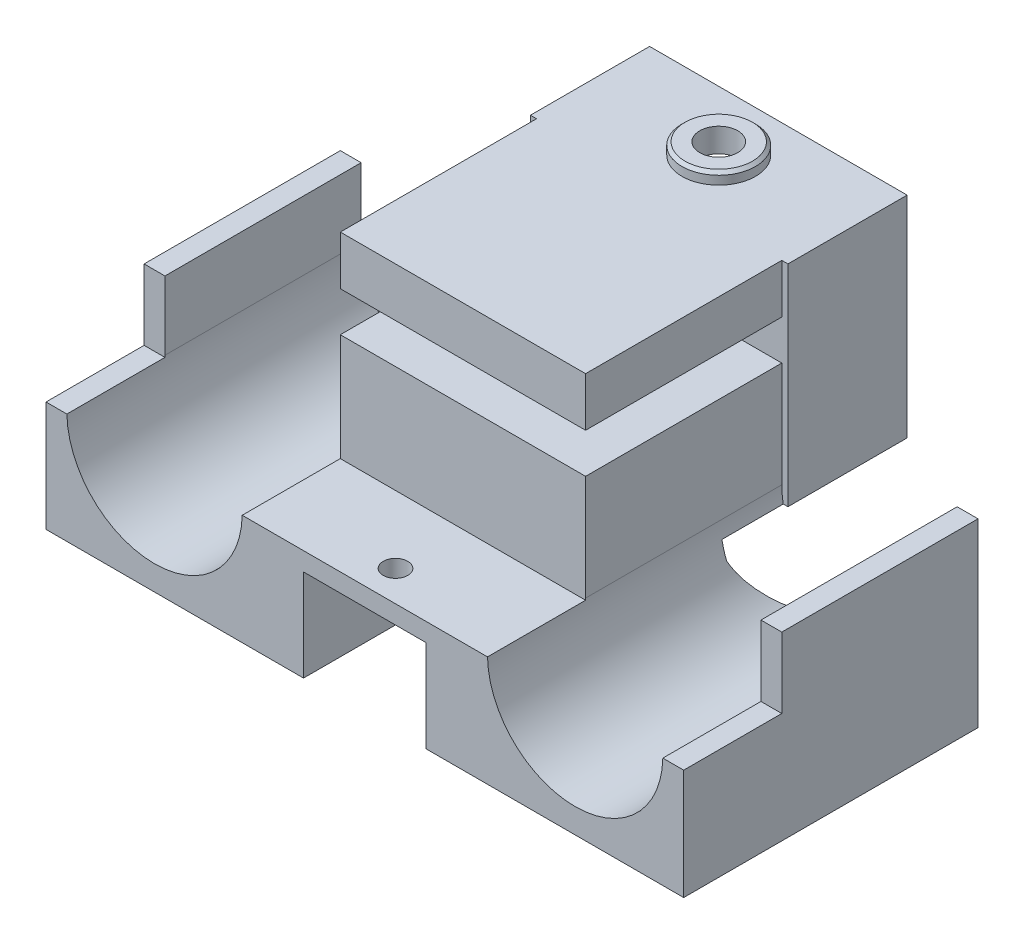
SolidWorks part; units mm, degrees
ref_plane "Front Plane" through (0, 0, 0) normal (0, 0, 1) x (1, 0, 0)
ref_plane "Top Plane" through (0, 0, 0) normal (0, 1, 0) x (1, 0, 0)
ref_plane "Right Plane" through (0, 0, 0) normal (1, 0, 0) x (0, 0, -1)
sketch "Sketch1" plane through (0, 0, 0) normal (0, 1, 0) x (1, 0, 0)
  line L1 (-10.5, -4.86) -> (10.5, -4.86)
  line L2 (-10.5, -4.86) -> (-10.5, 4.86)
  line L3 (-10.5, 4.86) -> (10.5, 4.86)
  line L4 (10.5, -4.86) -> (10.5, 4.86)
  line L5 (-10.5, -4.86) -> (10.5, 4.86) construction
  line L6 (-10.5, 4.86) -> (10.5, -4.86) construction
  point P0 (0, 0)
  dimension "D1" = 9.72
  dimension "D2" = 21
extrude "Boss-Extrude1" add sketch "Sketch1" along normal mid plane 17.15 contours L2 L3 L4 L1
sketch "Sketch2" plane through (0, 8.575, 0) normal (0, 1, 0) x (1, 0, 0)
  circle A0 centre (0, 0) radius 3
  circle A1 centre (0, 0) radius 1.55
  dimension "D1" = 6
  dimension "D2" = 3.1
extrude "Boss-Extrude2" add sketch "Sketch2" along normal blind 0.95 contours A0 | A1
chamfer "Chamfer1" distance 0.25 angle 45 1 edges at (0, 9.525, 3)
sketch "Sketch4" plane through (0, 8.575, 0) normal (0, 1, 0) x (1, 0, 0)
  circle A0 centre (0, 0) radius 1.55 construction
  circle A1 centre (0, 0) radius 1.55
extrude "Cut-Extrude2" cut sketch "Sketch4" against normal through all
mirror "Mirror1" about plane through (0, 0, 0) normal (0, 1, 0) of "Boss-Extrude2", "Chamfer1"
sketch "Sketch3" plane through (0, 0, -4.86) normal (0, 0, -1) x (-1, 0, 0)
  line L0 (10.5, 8.575) -> (-10.5, 8.575) construction
  line L1 (8.5, -6.825) -> (-8.5, -6.825)
  line L2 (8.5, -6.825) -> (8.5, 6.825)
  line L3 (8.5, 6.825) -> (-8.5, 6.825)
  line L4 (-8.5, -6.825) -> (-8.5, 6.825)
  line L5 (8.5, -6.825) -> (-8.5, 6.825) construction
  line L6 (8.5, 6.825) -> (-8.5, -6.825) construction
  line L7 (-10.5, 8.575) -> (-10.5, -8.575) construction
  point P0 (0, 0)
  dimension "D1" = 1.75
  dimension "D2" = 2
extrude "Cut-Extrude1" cut sketch "Sketch3" against normal blind 8.72 contours L4 L3 L2 L1
sketch "Sketch6" plane through (0, 6.825, 0) normal (0, -1, 0) x (1, 0, 0)
  circle A0 centre (0, 0) radius 3
  dimension "D1" = 6
extrude "Cut-Extrude3" cut sketch "Sketch6" against normal blind 0.75
mirror "Mirror2" about plane through (0, 0, 0) normal (0, 1, 0) of "Cut-Extrude3"
sketch "Sketch7" plane through (0, 0, 4.86) normal (0, 0, 1) x (1, 0, 0)
  line L1 (-10.5, 4.575) -> (10.5, 4.575)
  line L2 (-10.5, 4.575) -> (-10.5, 1.325)
  line L3 (-10.5, 1.325) -> (10.5, 1.325)
  line L4 (-10.5, -8.575) -> (10.5, -8.575)
  line L5 (10.5, -8.575) -> (10.5, 8.575)
  line L6 (10.5, 8.575) -> (-10.5, 8.575)
  line L7 (-10.5, 8.575) -> (-10.5, -8.575)
  line L8 (-10.5, -8.575) -> (10.5, -8.575)
  line L9 (10.5, -8.575) -> (10.5, 8.575)
  line L10 (10.5, 8.575) -> (-10.5, 8.575)
  line L11 (-10.5, 8.575) -> (-10.5, -8.575)
  line L12 (10.5, 4.575) -> (10.5, 1.325)
  line L13 (-10.5, 4.575) -> (10.5, 1.325) construction
  line L14 (-10.5, 1.325) -> (10.5, 4.575) construction
  point P8 (0, 2.95)
  point P9 (0, 0)
  point P10 (0, 0)
  dimension "D2" = 3.25
  dimension "D3" = 4
  dimension "D1" = 0
sketch "Sketch8" plane through (0, 0, 4.86) normal (0, 0, 1) x (1, 0, 0)
  line L22 (-10.5, 1.325) -> (10.5, 1.325)
  line L27 (-10.5, 1.325) -> (-10.5, -1.675)
  line L28 (-10.5, -1.675) -> (10.5, -1.675)
  line L29 (-10.5, -8.575) -> (10.5, -8.575)
  line L30 (10.5, -8.575) -> (10.5, 8.575)
  line L31 (10.5, 8.575) -> (-10.5, 8.575)
  line L32 (-10.5, 8.575) -> (-10.5, -8.575)
  line L33 (-10.5, -8.575) -> (10.5, -8.575)
  line L34 (10.5, -8.575) -> (10.5, 8.575)
  line L35 (10.5, 8.575) -> (-10.5, 8.575)
  line L36 (-10.5, 8.575) -> (-10.5, -8.575)
  line L37 (10.5, 1.325) -> (10.5, -1.675)
  line L38 (-10.5, 1.325) -> (10.5, -1.675) construction
  line L39 (-10.5, -1.675) -> (10.5, 1.325) construction
  line L40 (-10.5, 4.575) -> (10.5, 4.575)
  line L41 (-10.5, 4.575) -> (-10.5, 8.575)
  line L42 (-10.5, 8.575) -> (10.5, 8.575)
  line L43 (10.5, 4.575) -> (10.5, 8.575)
  line L44 (-10.5, 4.575) -> (10.5, 8.575) construction
  line L45 (-10.5, 8.575) -> (10.5, 4.575) construction
  point P8 (0, -0.175)
  point P9 (10.5, 0.7649)
  point P14 (0, 6.575)
  dimension "D1" = 0
  dimension "D2" = 3
  dimension "D3" = 4
extrude "Boss-Extrude3" add sketch "Sketch8" along normal blind 16 contours L28 L22 M7 M5 | L42 L36 L40 L34
sketch "Sketch9" plane through (0, 0, 0) normal (1, 0, 0) x (0, 0, -1)
  line L0 (-20.86, -1.675) -> (-20.86, -7.425)
  line L1 (-20.86, -7.425) -> (-28.86, -7.425)
  line L2 (-28.86, -7.425) -> (-28.86, -8.925)
  line L3 (-28.86, -8.925) -> (-12.86, -8.925)
  line L4 (-12.86, -8.925) -> (-4.86, -8.575)
  line L5 (-12.86, -1.675) -> (-12.86, -8.925) construction
  line L14 (-20.86, 8.575) -> (-20.86, 4.575)
  line L15 (-20.86, 8.575) -> (-20.86, 4.575)
  line L16 (-20.86, 4.575) -> (-4.86, 4.575)
  line L17 (-4.86, -1.675) -> (-4.86, -8.575)
  line L18 (-4.86, -8.575) -> (4.86, -8.575)
  line L19 (4.86, -8.575) -> (4.86, 8.575)
  line L20 (4.86, 8.575) -> (-20.86, 8.575)
  line L22 (-20.86, 4.575) -> (-4.86, 4.575)
  line L23 (-4.86, 4.575) -> (-4.86, 1.325)
  line L29 (-4.86, -1.675) -> (-4.86, -8.575)
  line L30 (-4.86, -8.575) -> (4.86, -8.575)
  line L31 (4.86, -8.575) -> (4.86, 8.575)
  line L32 (4.86, 8.575) -> (-20.86, 8.575)
  line L41 (-4.86, 4.575) -> (-4.86, 1.325)
  line L42 (-4.86, 1.325) -> (-20.86, 1.325)
  line L43 (-4.86, 1.325) -> (-20.86, 1.325)
  line L44 (-20.86, 1.325) -> (-20.86, -1.675)
  line L45 (-20.86, 1.325) -> (-20.86, -1.675)
  line L46 (-20.86, -1.675) -> (-4.86, -1.675)
  line L47 (-20.86, -1.675) -> (-4.86, -1.675)
  dimension "D2" = 12
  dimension "D3" = 8
  dimension "D4" = 1.5
  dimension "D1" = 0
extrude "Boss-Extrude4" add sketch "Sketch9" along normal mid plane 10
sketch "Sketch11" plane through (0, -8.925, 0) normal (0, -1, 0) x (1, 0, 0)
  line L0 (5, 20.86) -> (-5, 20.86) construction
  line L1 (5, 20.86) -> (-5, 20.86)
  line L2 (0, 26.36) -> (0, 20.86) construction
  circle A0 centre (0, 26.36) radius 1
  dimension "D1" = 2
  dimension "D2" = 5.5
extrude "Cut-Extrude6" cut sketch "Sketch11" against normal through all contours A0
sketch "Sketch12" plane through (5, 0, 0) normal (1, 0, 0) x (0, 0, -1)
  line L7 (-28.86, -8.925) -> (-12.86, -8.925)
  line L8 (-12.86, -8.925) -> (-4.86, -8.575)
  line L9 (-4.86, -8.575) -> (-4.86, -1.675)
  line L10 (-4.86, -1.675) -> (-20.86, -1.675)
  line L11 (-20.86, -1.675) -> (-20.86, -7.425)
  line L12 (-20.86, -7.425) -> (-28.86, -7.425)
  line L13 (-28.86, -7.425) -> (-28.86, -8.925)
  line L14 (-28.86, -8.925) -> (-12.86, -8.925)
  line L16 (-4.86, -8.575) -> (-4.86, -1.675)
  line L17 (-4.86, -1.675) -> (-20.86, -1.675)
  line L18 (-20.86, -1.675) -> (-20.86, -7.425)
  line L19 (-20.86, -7.425) -> (-28.86, -7.425)
  line L20 (-28.86, -7.425) -> (-28.86, -8.925)
  line L21 (-12.86, -8.925) -> (-4.86, -8.575)
  point P2 (0, 0)
  dimension "D1" = 0
ref_plane "Plane1" through (26, 0, 0) normal (1, 0, 0) x (0, 0, -1)
sketch "Sketch13" plane through (26, 0, 0) normal (1, 0, 0) x (0, 0, -1)
  line L0 (-20.86, -7.425) -> (-28.86, -7.425) construction
  line L1 (-28.86, -16.425) -> (-4.86, -16.425)
  line L2 (-28.86, -16.425) -> (-28.86, -1.675)
  line L3 (-28.86, -1.675) -> (-4.86, -1.675)
  line L4 (-4.86, -16.425) -> (-4.86, -1.675)
  line L5 (-28.86, -16.425) -> (-4.86, -1.675) construction
  line L6 (-28.86, -1.675) -> (-4.86, -16.425) construction
  line L7 (-20.86, -1.675) -> (-20.86, -7.425)
  line L8 (-20.86, -7.425) -> (-28.86, -7.425)
  point P4 (-16.86, -9.05)
  dimension "D1" = 9
extrude "Boss-Extrude5" add sketch "Sketch13" against normal up to surface (21 mm away) contours L7 L8 L2 L1 L4 L3
ref_plane "Plane2" through (-26, 0, 0) normal (1, 0, 0) x (0, 0, -1)
sketch "Sketch14" plane through (-26, 0, 0) normal (1, 0, 0) x (0, 0, -1)
  line L0 (-20.86, -1.675) -> (-20.86, -7.425) construction
  line L1 (-20.86, -7.425) -> (-28.86, -7.425) construction
  line L2 (-20.86, -1.675) -> (-20.86, -7.425)
  line L3 (-20.86, -7.425) -> (-28.86, -7.425)
  line L4 (-28.86, -16.425) -> (-4.86, -16.425)
  line L5 (-4.86, -16.425) -> (-4.86, -1.675)
  line L6 (-4.86, -1.675) -> (-28.86, -1.675)
  line L7 (-28.86, -1.675) -> (-28.86, -16.425)
  line L8 (-28.86, -16.425) -> (-4.86, -16.425)
  line L9 (-4.86, -16.425) -> (-4.86, -1.675)
  line L10 (-4.86, -1.675) -> (-28.86, -1.675)
  line L11 (-28.86, -1.675) -> (-28.86, -16.425)
  dimension "D1" = 0
extrude "Boss-Extrude6" add sketch "Sketch14" along normal up to surface (21 mm away) contours L3 L11 L8 L9 L10 L2
sketch "Sketch15" plane through (0, 0, 28.86) normal (0, 0, 1) x (1, 0, 0)
  line L0 (-17.15, -14.425) -> (17.15, -14.425) construction
  line L1 (26, -7.425) -> (-26, -7.425) construction
  line L3 (-24.3, -7.275) -> (-24.3, -1.675)
  line L4 (-10.5, -1.675) -> (-26, -1.675) construction
  line L5 (-24.3, -1.675) -> (-10, -1.675)
  line L6 (-10, -1.675) -> (-10, -7.275)
  line L7 (10, -7.275) -> (10, -1.675)
  line L8 (10, -1.675) -> (24.3, -1.675)
  line L9 (10.5, -1.675) -> (26, -1.675) construction
  line L10 (24.3, -1.675) -> (24.3, -7.275)
  line L12 (-10, -1.675) -> (-10.5, -1.675)
  line L13 (-10, -1.675) -> (-10, 8.575)
  line L14 (-10, 8.575) -> (-10.5, 8.575)
  line L15 (-10.5, -1.675) -> (-10.5, 8.575)
  line L16 (-10, -1.675) -> (-10.5, 8.575) construction
  line L17 (-10, 8.575) -> (-10.5, -1.675) construction
  line L18 (10, -1.675) -> (10.5, -1.675)
  line L19 (10, -1.675) -> (10, 8.575)
  line L20 (10, 8.575) -> (10.5, 8.575)
  line L21 (10.5, -1.675) -> (10.5, 8.575)
  line L22 (10, -1.675) -> (10.5, 8.575) construction
  line L23 (10, 8.575) -> (10.5, -1.675) construction
  circle A0 centre (-17.15, -7.275) radius 7.15
  circle A1 centre (17.15, -7.275) radius 7.15
  point P4 (-17.15, -14.425)
  point P5 (17.15, -14.425)
  point P10 (10, -7.275)
  point P11 (-10, -7.275)
  point P28 (-10.25, 3.45)
  point P33 (10.25, 3.45)
  dimension "D1" = 14.3
  dimension "D2" = 14.3
  dimension "D3" = 7
  dimension "D4" = 10
  dimension "D5" = 10
extrude "Cut-Extrude7" cut sketch "Sketch15" against normal up to surface (24 mm away) contours L5 A0 | A0 L5 M5 | A0 L5 L3 | A0 M5 | A0 L6 L5 | A1 L8 L7 | A1 L8 M5 | A1 L10 L8 | A1 M5 | L15 L5 L13 L14 | L8 L21 L20 L19
sketch "Sketch17" plane through (0, 0, 4.86) normal (0, 0, -1) x (-1, 0, 0)
  line L0 (24.3, -1.675) -> (24.3, -7.275) construction
  line L1 (10.1192, -8.575) -> (5, -8.575) construction
  line L2 (5, -8.575) -> (5, -16.425) construction
  line L3 (5, -16.425) -> (26, -16.425) construction
  line L4 (26, -16.425) -> (26, -1.675) construction
  line L5 (26, -1.675) -> (24.3, -1.675) construction
  line L6 (-24.3, -7.275) -> (-24.3, -1.675) construction
  line L7 (-24.3, -1.675) -> (-26, -1.675) construction
  line L8 (-26, -1.675) -> (-26, -16.425) construction
  line L9 (-26, -16.425) -> (-5, -16.425) construction
  line L10 (-5, -16.425) -> (-5, -8.575) construction
  line L11 (-5, -8.575) -> (-10.1192, -8.575) construction
  line L12 (24.3, -1.675) -> (24.3, -7.275)
  line L13 (10.1192, -8.575) -> (5, -8.575)
  line L14 (5, -8.575) -> (5, -16.425)
  line L15 (5, -16.425) -> (26, -16.425)
  line L16 (26, -16.425) -> (26, -1.675)
  line L17 (26, -1.675) -> (24.3, -1.675)
  line L18 (-24.3, -7.275) -> (-24.3, -1.675)
  line L19 (-24.3, -1.675) -> (-26, -1.675)
  line L20 (-26, -1.675) -> (-26, -16.425)
  line L21 (-26, -16.425) -> (-5, -16.425)
  line L22 (-5, -16.425) -> (-5, -8.575)
  line L23 (-5, -8.575) -> (-10.1192, -8.575)
  line L24 (10.5, 8.575) -> (10.5, -8.575) construction
  line L25 (-10.5, -8.575) -> (10.5, -8.575)
  line L26 (-10.5, -8.575) -> (-10.5, -16.425)
  line L27 (-10.5, -16.425) -> (10.5, -16.425)
  line L28 (10.5, -8.575) -> (10.5, -16.425)
  line L29 (-10.5, -8.575) -> (10.5, -16.425) construction
  line L30 (-10.5, -16.425) -> (10.5, -8.575) construction
  arc A0 (10.1192, -8.575) -> (24.3, -7.275) centre (17.15, -7.275) ccw construction
  arc A1 (-24.3, -7.275) -> (-10.1192, -8.575) centre (-17.15, -7.275) ccw construction
  arc A2 (10.1192, -8.575) -> (24.3, -7.275) centre (17.15, -7.275) ccw
  arc A3 (-24.3, -7.275) -> (-10.1192, -8.575) centre (-17.15, -7.275) ccw
  point P11 (0, -12.5)
extrude "Cut-Extrude8" cut sketch "Sketch17" against normal blind 5 contours L27 L28 L25 L26
chamfer "Chamfer2" distance 5 angle 45 2 edges at (-10.5, -13.1634, 4.86) (10.5, -13.1634, 4.86)
sketch "Sketch18" plane through (5, 0, 0) normal (-1, 0, 0) x (0, 0, 1)
  line L0 (19.36, -8.925) -> (19.36, -16.425)
  line L5 (9.86, -8.7938) -> (9.86, -16.425)
  line L6 (9.86, -16.425) -> (28.86, -16.425)
  line L7 (28.86, -16.425) -> (28.86, -8.925)
  line L8 (28.86, -8.925) -> (12.86, -8.925)
  line L9 (12.86, -8.925) -> (9.86, -8.7938)
  line L10 (9.86, -8.7938) -> (9.86, -16.425)
  line L11 (9.86, -16.425) -> (28.86, -16.425)
  line L12 (28.86, -16.425) -> (28.86, -8.925)
  line L13 (28.86, -8.925) -> (12.86, -8.925)
  line L14 (12.86, -8.925) -> (9.86, -8.7938)
  dimension "D1" = 0
extrude "Boss-Extrude7" add sketch "Sketch18" along normal up to surface (10 mm away) contours L0 M10 M11 M7 M8
